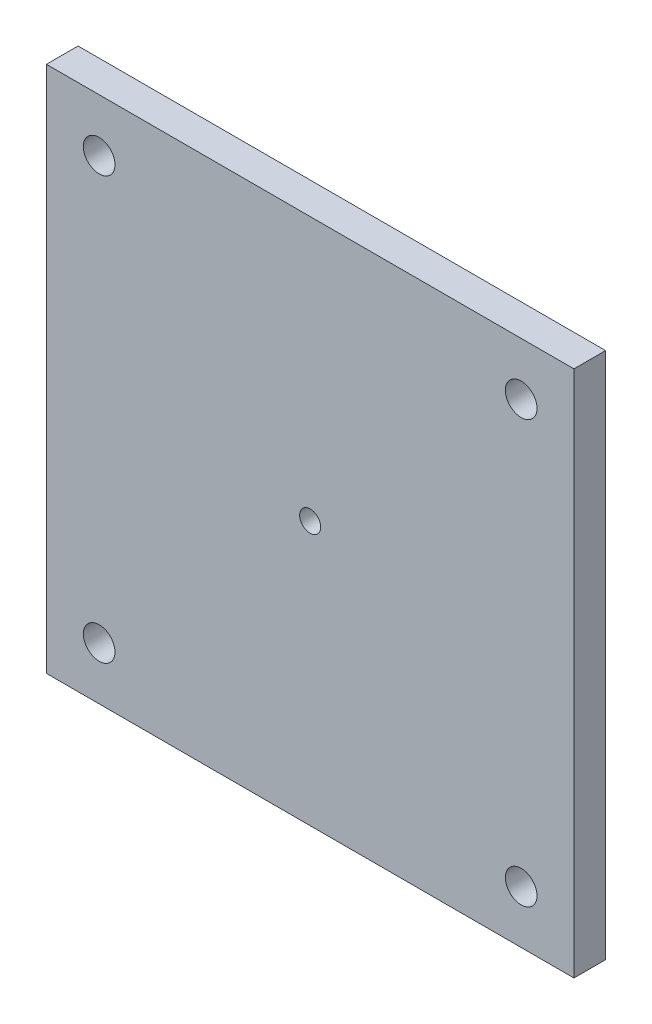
SolidWorks part; units mm, degrees
ref_plane "Alzado" through (0, 0, 0) normal (0, 0, 1) x (1, 0, 0)
ref_plane "Planta" through (0, 0, 0) normal (0, 1, 0) x (1, 0, 0)
ref_plane "Vista lateral" through (0, 0, 0) normal (1, 0, 0) x (0, 0, -1)
sketch "Croquis1" plane through (0, 0, 0) normal (0, 0, 1) x (1, 0, 0)
  line L1 (-25, -25) -> (25, -25)
  line L2 (-25, -25) -> (-25, 25)
  line L3 (-25, 25) -> (25, 25)
  line L4 (25, -25) -> (25, 25)
  line L5 (-25, -25) -> (25, 25) construction
  line L6 (-25, 25) -> (25, -25) construction
  line L7 (-20, -20) -> (20, -20) construction
  line L8 (-20, -20) -> (-20, 20) construction
  line L9 (-20, 20) -> (20, 20) construction
  line L10 (20, -20) -> (20, 20) construction
  line L11 (-20, -20) -> (20, 20) construction
  line L12 (-20, 20) -> (20, -20) construction
  circle A0 centre (-20, 20) radius 1.5
  circle A1 centre (20, 20) radius 1.5
  circle A2 centre (20, -20) radius 1.5
  circle A3 centre (-20, -20) radius 1.5
  circle A4 centre (0, 0) radius 1
  point P0 (0, 0)
  point P6 (0, 0)
  dimension "D5" = 3
  dimension "D6" = 3
  dimension "D7" = 3
  dimension "D8" = 3
  dimension "D9" = 2
  dimension "D1" = 50
  dimension "D2" = 50
  dimension "D3" = 40
  dimension "D4" = 40
extrude "Saliente-Extruir1" add sketch "Croquis1" along normal blind 3
